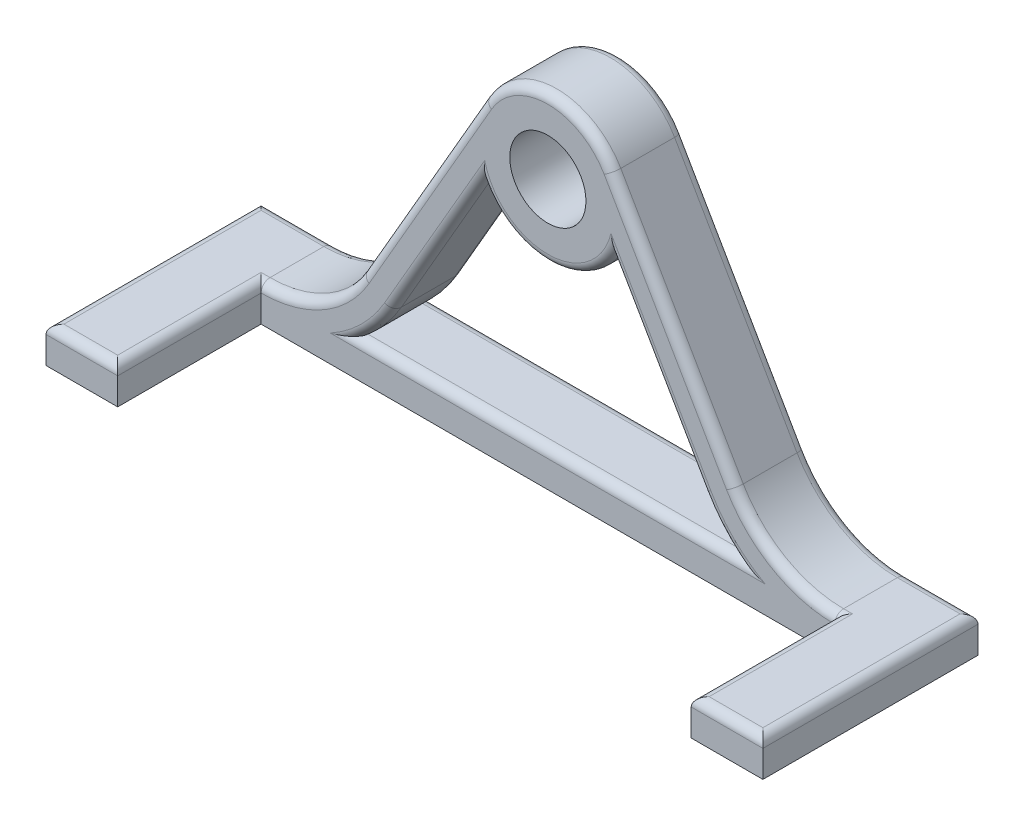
SolidWorks part; units mm, degrees
ref_plane "Front" through (0, 0, 0) normal (0, 0, 1) x (1, 0, 0)
ref_plane "Top" through (0, 0, 0) normal (0, 1, 0) x (1, 0, 0)
ref_plane "Right" through (0, 0, 0) normal (1, 0, 0) x (0, 0, -1)
sketch "Sketch1" plane through (0, 0, 0) normal (0, 0, 1) x (1, 0, 0)
  line L0 (-63.5, 0) -> (63.5, 0)
  line L1 (11.3422, 54.1734) -> (33.0297, 16.6097)
  line L2 (-11.3422, 54.1734) -> (-33.0297, 16.6097)
  line L3 (50.8, 6.35) -> (63.5, 6.35)
  line L4 (0, 0) -> (0, 60.7219) construction
  line L5 (-50.8, 6.35) -> (-63.5, 6.35)
  line L6 (63.5, 6.35) -> (63.5, 0)
  line L7 (-63.5, 6.35) -> (-63.5, 0)
  circle A0 centre (0, 47.625) radius 6.7469
  arc A1 (-11.3422, 54.1734) -> (11.3422, 54.1734) centre (0, 47.625) cw
  arc A2 (33.0297, 16.6097) -> (50.8, 6.35) centre (50.8, 26.8694) ccw
  arc A3 (-33.0297, 16.6097) -> (-50.8, 6.35) centre (-50.8, 26.8694) cw
  dimension "D3" = 13.4937
  dimension "D2" = 127
  dimension "D1" = 6.35
  dimension "D7" = 12.7
  dimension "D4" = 47.625
  dimension "D5" = 60
  dimension "D6" = 6.35
extrude "Base-Extrude" add sketch "Sketch1" along normal blind 12.7
sketch "Sketch5" plane through (0, 0, 12.7) normal (0, 0, 1) x (1, 0, 0)
  line L7 (-33.453, 6.35) -> (33.453, 6.35)
  line L8 (27.5304, 13.4347) -> (5.843, 50.9984)
  line L9 (-5.843, 50.9984) -> (-27.5304, 13.4347)
  line L10 (-33.453, 6.35) -> (33.453, 6.35)
  line L11 (27.5304, 13.4347) -> (11.4556, 41.277)
  line L12 (-11.4556, 41.277) -> (-27.5304, 13.4347)
  circle A1 centre (0, 47.625) radius 13.0969
  arc A2 (-11.4556, 41.277) -> (11.4556, 41.277) centre (0, 47.625) ccw
  arc A5 (27.5304, 13.4347) -> (33.453, 6.35) centre (50.8, 26.8694) ccw
  arc A6 (5.843, 50.9984) -> (-5.843, 50.9984) centre (0, 47.625) ccw
  arc A7 (-33.453, 6.35) -> (-27.5304, 13.4347) centre (-50.8, 26.8694) ccw
  arc A8 (27.5304, 13.4347) -> (33.453, 6.35) centre (50.8, 26.8694) ccw
  arc A10 (-33.453, 6.35) -> (-27.5304, 13.4347) centre (-50.8, 26.8694) ccw
  dimension "D1" = 6.35
  dimension "D2" = 6.35
extrude "Cut-Extrude3" cut sketch "Sketch5" against normal through all
sketch "Sketch7" plane through (0, 0, 0) normal (0, -1, 0) x (1, 0, 0)
  line L0 (63.5, 0) -> (50.8, 0)
  line L1 (63.5, 0) -> (63.5, 38.1)
  line L2 (50.8, 38.1) -> (63.5, 38.1)
  line L3 (50.8, 38.1) -> (50.8, 0)
  line L4 (50.8, 12.7) -> (50.8, 0) construction
  line L5 (-63.5, 0) -> (-50.8, 0)
  line L6 (-63.5, 0) -> (-63.5, 38.1)
  line L7 (-50.8, 38.1) -> (-63.5, 38.1)
  line L8 (-50.8, 38.1) -> (-50.8, 0)
  line L9 (-50.8, 12.7) -> (-50.8, 0) construction
  dimension "D1" = 38.1
extrude "Boss-Extrude1" add sketch "Sketch7" against normal blind 6.35
fillet "Fillet1" radius 1.5875
fillet "Fillet2" radius 1.5875
